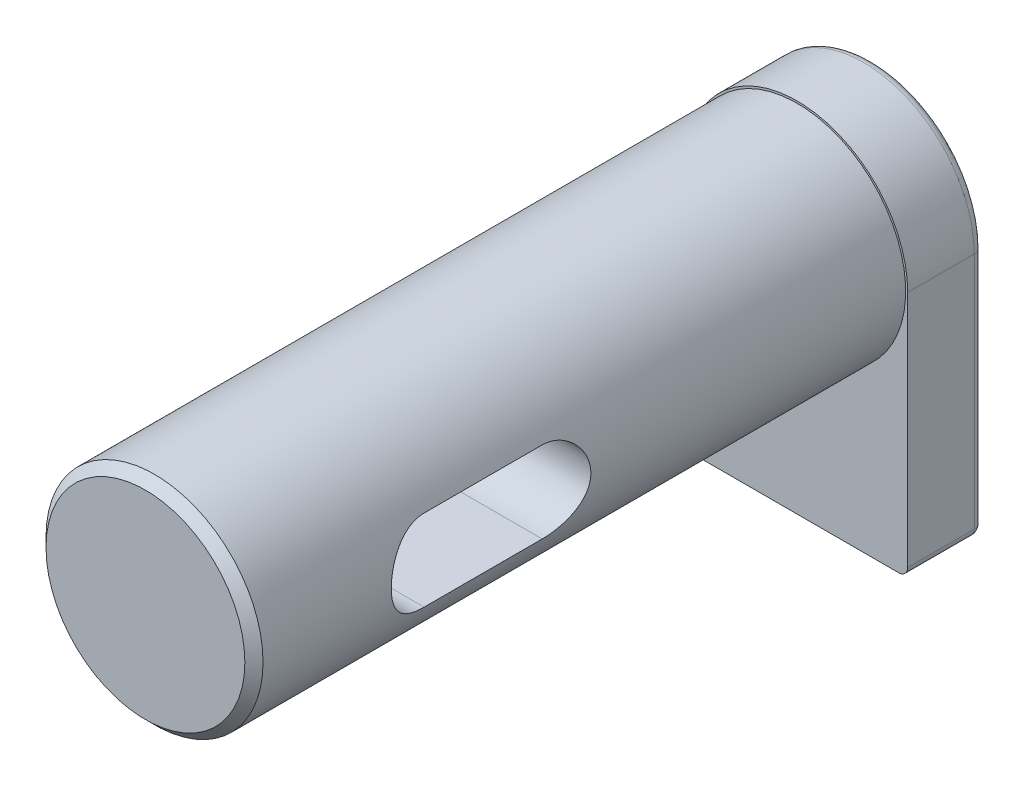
SolidWorks part; units mm, degrees
ref_plane "Спереди" through (0, 0, 0) normal (0, 0, 1) x (1, 0, 0)
ref_plane "Сверху" through (0, 0, 0) normal (0, 1, 0) x (1, 0, 0)
ref_plane "Справа" through (0, 0, 0) normal (1, 0, 0) x (0, 0, -1)
sketch "Эскиз1" plane through (0, 0, 0) normal (0, 0, 1) x (1, 0, 0)
  line L0 (4.826, 0) -> (4.826, -10.3981)
  line L1 (4.4291, -10.795) -> (-4.4291, -10.795)
  line L2 (-4.826, -10.3981) -> (-4.826, 0)
  arc A0 (-4.826, 0) -> (4.826, 0) centre (0, 0) cw
  arc A1 (4.826, -10.3981) -> (4.4291, -10.795) centre (4.4291, -10.3981) cw
  arc A2 (-4.4291, -10.795) -> (-4.826, -10.3981) centre (-4.4291, -10.3981) cw
  dimension "D3" = 0.3969
  dimension "D1" = 9.652
  dimension "D2" = 10.795
extrude "Бобышка-Вытянуть1" add sketch "Эскиз1" along normal blind 3.302
sketch "Эскиз2" plane through (0, 0, 3.302) normal (0, 0, 1) x (1, 0, 0)
  circle A0 centre (0, 0) radius 4.7371
  dimension "D1" = 9.4742
extrude "Бобышка-Вытянуть2" add sketch "Эскиз2" along normal blind 28.448
sketch "Эскиз3" plane through (0, 0, 0) normal (1, 0, 0) x (0, 0, -1)
  line L0 (-23.9776, 0) -> (-18.8214, 0) construction
  line L1 (-23.9776, 1.778) -> (-18.8214, 1.778)
  line L2 (-23.9776, -1.778) -> (-18.8214, -1.778)
  line L3 (-3.302, -10.3981) -> (-3.302, 0) construction
  arc A0 (-23.9776, 1.778) -> (-23.9776, -1.778) centre (-23.9776, 0) ccw
  arc A1 (-18.8214, -1.778) -> (-18.8214, 1.778) centre (-18.8214, 0) ccw
  point P3 (-21.3995, 0)
  dimension "D1" = 3.556
  dimension "D2" = 5.1562
  dimension "D3" = 15.5194
extrude "Вырез-Вытянуть1" cut sketch "Эскиз3" against normal mid plane 28.448
fillet "Скругление1" radius 0.3969 6 edges at (4.826, -5.1991, 0) (4.7098, -10.6788, 0) (0, -10.795, 0) (-4.7098, -10.6788, 0) (-4.826, -5.1991, 0) (0, 4.826, 0)
chamfer "Фаска1" distance 0.3969 angle 45 1 edges at (4.7371, 0, 31.75)
